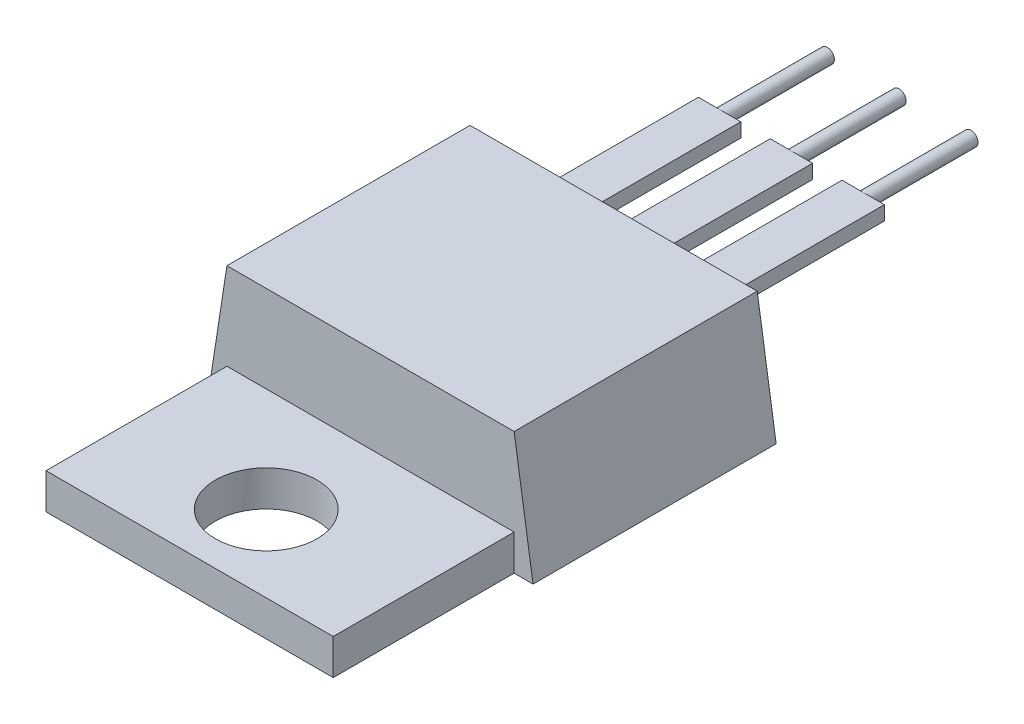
SolidWorks part; units mm, degrees
ref_plane "Спереди" through (0, 0, 0) normal (0, 0, 1) x (1, 0, 0)
ref_plane "Сверху" through (0, 0, 0) normal (0, 1, 0) x (1, 0, 0)
ref_plane "Справа" through (0, 0, 0) normal (1, 0, 0) x (0, 0, -1)
sketch "Эскиз1" plane through (0, 0, 0) normal (0, 0, 1) x (1, 0, 0)
  line L0 (-5.75, -2.7) -> (5.75, -2.7)
  line L1 (-5.08, 1.64) -> (5.08, 1.64)
  line L2 (5.75, -2.7) -> (5.08, 1.64)
  line L3 (-5.75, -2.7) -> (-5.08, 1.64)
extrude "Бобышка-Вытянуть1" add sketch "Эскиз1" along normal blind 8.6
sketch "Эскиз2" plane through (0, 0, 8.6) normal (0, 0, 1) x (1, 0, 0)
  line L0 (-5.75, -2.7) -> (5.75, -2.7) construction
  line L2 (-5.08, -2.7) -> (5.08, -2.7)
  line L3 (-5.08, -2.7) -> (-5.08, -1.44)
  line L4 (-5.08, -1.44) -> (5.08, -1.44)
  line L6 (5.08, -2.7) -> (5.08, -1.44)
extrude "Бобышка-Вытянуть2" add sketch "Эскиз2" along normal blind 6.4 and the other way blind 7.6 separate body
sketch "Эскиз3" plane through (0, -1.44, 0) normal (0, 1, 0) x (1, 0, 0)
  circle A0 centre (0, -12.29) radius 1.8
extrude "Вырез-Вытянуть1" cut sketch "Эскиз3" against normal up to surface (1.26 mm away)
sketch "Эскиз4" plane through (0, 0, 0) normal (0, 0, -1) x (-1, 0, 0)
  line L1 (-0.75, 0.25) -> (0.75, 0.25)
  line L2 (-0.75, 0.25) -> (-0.75, -0.25)
  line L3 (-0.75, -0.25) -> (0.75, -0.25)
  line L4 (0.75, 0.25) -> (0.75, -0.25)
  line L5 (-1.79, 0.25) -> (-3.29, 0.25)
  line L6 (-1.79, 0.25) -> (-1.79, -0.25)
  line L7 (-1.79, -0.25) -> (-3.29, -0.25)
  line L8 (-3.29, 0.25) -> (-3.29, -0.25)
  line L9 (1.79, 0.25) -> (3.29, 0.25)
  line L10 (1.79, 0.25) -> (1.79, -0.25)
  line L11 (1.79, -0.25) -> (3.29, -0.25)
  line L12 (3.29, 0.25) -> (3.29, -0.25)
extrude "Бобышка-Вытянуть3" add sketch "Эскиз4" along normal blind 6.29 separate body
sketch "Эскиз5" plane through (0, 0, -6.29) normal (0, 0, -1) x (-1, 0, 0)
  circle A0 centre (0, 0) radius 0.25
  circle A1 centre (-2.54, 0) radius 0.25
  circle A2 centre (2.54, 0) radius 0.25
extrude "Бобышка-Вытянуть4" add sketch "Эскиз5" along normal blind 3.81
